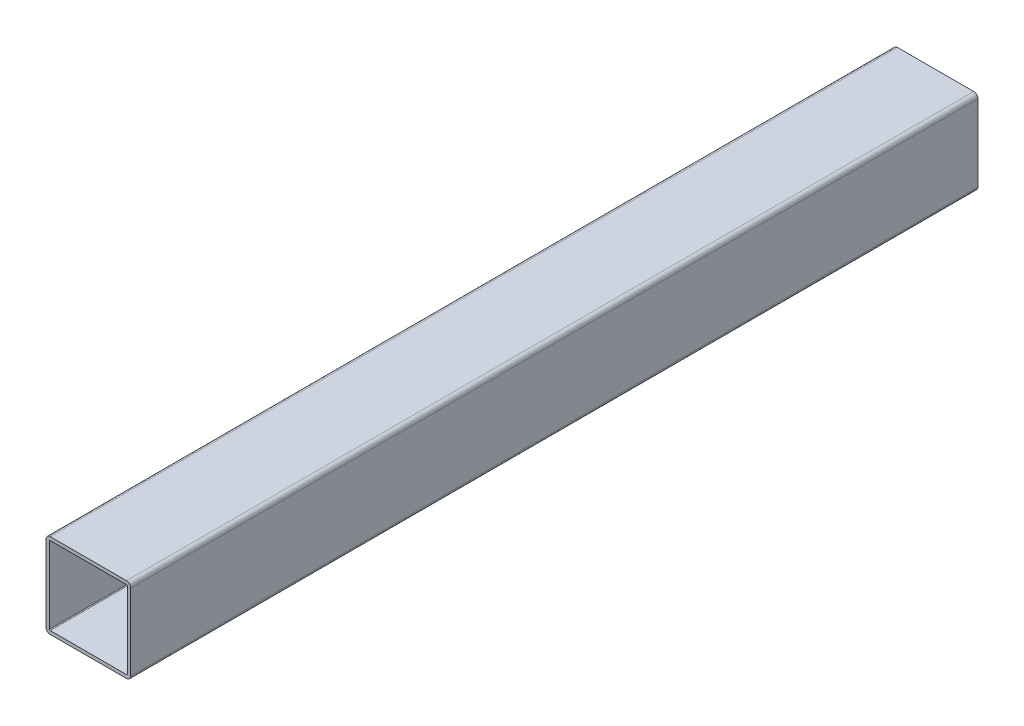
SolidWorks part; units mm, degrees
ref_plane "Face" through (0, 0, 0) normal (0, 0, 1) x (1, 0, 0)
ref_plane "Dessus" through (0, 0, 0) normal (0, 1, 0) x (1, 0, 0)
ref_plane "Droite" through (0, 0, 0) normal (1, 0, 0) x (0, 0, -1)
sketch "Esquisse1" plane through (0, 0, 0) normal (0, 0, 1) x (1, 0, 0)
  line L0 (5, -4) -> (95, -4)
  line L1 (5, 0) -> (95, 0)
  line L2 (0, -5) -> (0, -95)
  line L3 (5, -100) -> (95, -100)
  line L4 (100, -5) -> (100, -95)
  line L5 (96, -5) -> (96, -95)
  line L6 (5, -96) -> (95, -96)
  line L7 (4, -5) -> (4, -95)
  arc A0 (100, -5) -> (95, 0) centre (95, -5) ccw
  arc A1 (100, -95) -> (95, -100) centre (95, -95) cw
  arc A2 (0, -95) -> (5, -100) centre (5, -95) ccw
  arc A3 (5, 0) -> (0, -5) centre (5, -5) ccw
  arc A4 (96, -5) -> (95, -4) centre (95, -5) ccw
  arc A5 (96, -95) -> (95, -96) centre (95, -95) cw
  arc A6 (4, -95) -> (5, -96) centre (5, -95) ccw
  arc A7 (5, -4) -> (4, -5) centre (5, -5) ccw
  point P7 (100, 0)
  point P12 (0, -100)
  point P15 (0, 0)
  dimension "D3" = 5
  dimension "D1" = 100
  dimension "D2" = 100
  dimension "D4" = 4
extrude "Base-Extrusion" add sketch "Esquisse1" along normal blind 1000
